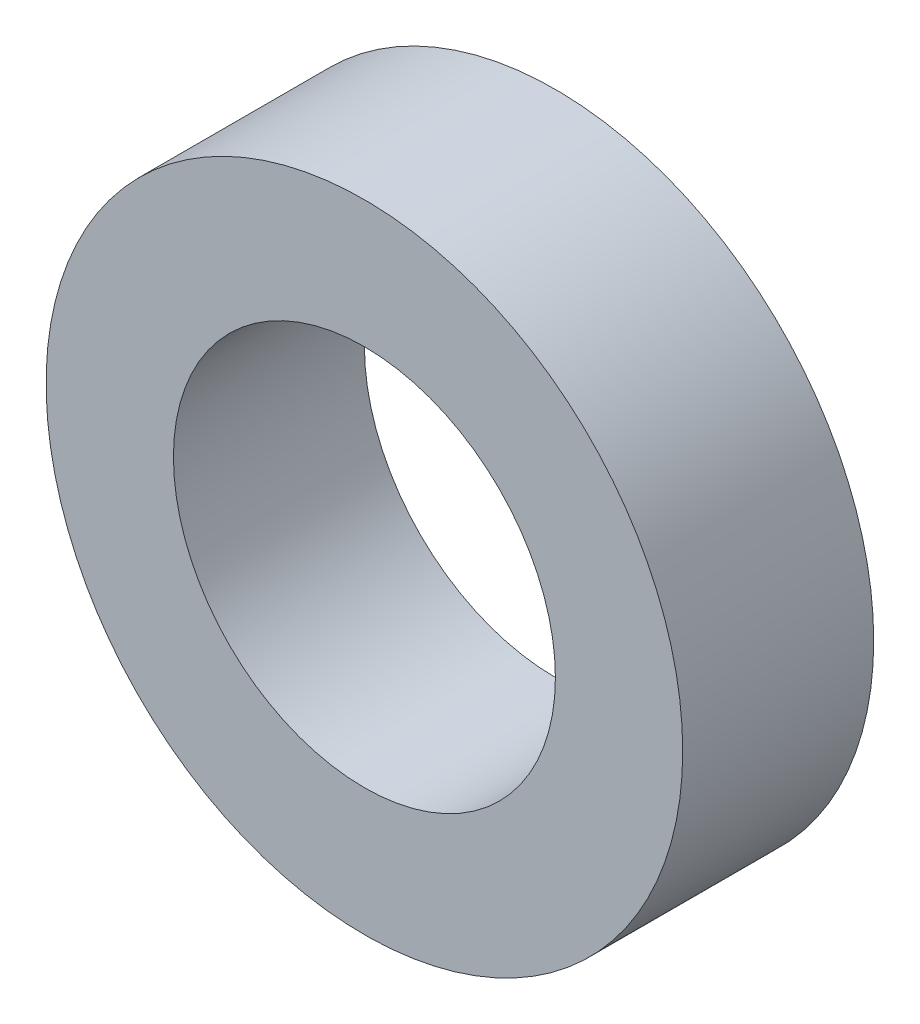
SolidWorks part; units mm, degrees
ref_plane "XY" through (0, 0, 0) normal (0, 0, 1) x (1, 0, 0)
ref_plane "XZ" through (0, 0, 0) normal (0, 1, 0) x (1, 0, 0)
ref_plane "YZ" through (0, 0, 0) normal (1, 0, 0) x (0, 0, -1)
sketch "Esquisse1" plane through (0, 0, 0) normal (0, 0, 1) x (1, 0, 0)
  circle A0 centre (0, 0) radius 1.5 construction
  circle A1 centre (0, 0) radius 1.5
  circle A2 centre (0, 0) radius 2.5
  dimension "D1" = 1
extrude "Boss.-Extru.1" add sketch "Esquisse1" along normal up to surface (1.5 mm away)
